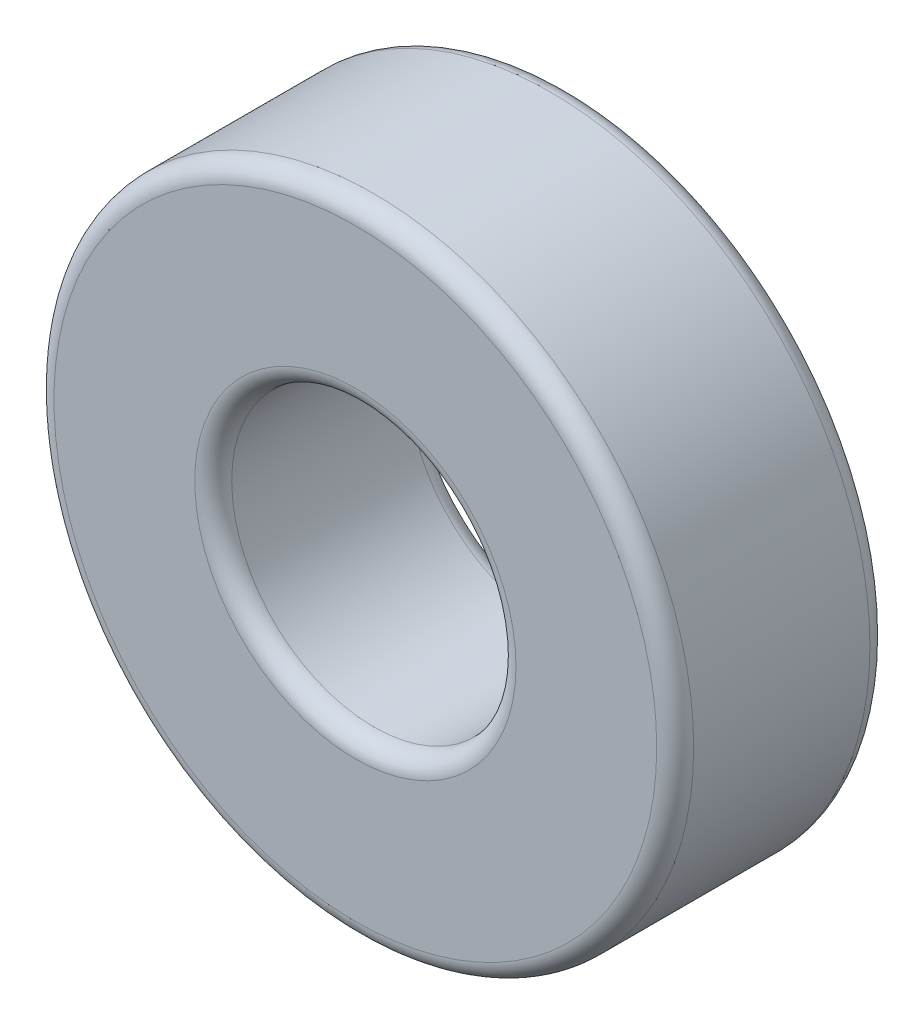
SolidWorks part; units mm, degrees
ref_plane "Front Plane" through (0, 0, 0) normal (0, 0, 1) x (1, 0, 0)
ref_plane "Top Plane" through (0, 0, 0) normal (0, 1, 0) x (1, 0, 0)
ref_plane "Right Plane" through (0, 0, 0) normal (1, 0, 0) x (0, 0, -1)
sketch "Sketch1" plane through (0, 0, 0) normal (0, 0, 1) x (1, 0, 0)
  circle A0 centre (0, 0) radius 14.2875
  circle A1 centre (0, 0) radius 6.35
  dimension "D1" = 12.7
  dimension "D2" = 28.575
extrude "Extrude1" add sketch "Sketch1" along normal mid plane 9.525
fillet "Fillet1" radius 0.8255 4 edges at (6.35, 0, -4.7625) (6.35, 0, 4.7625) (14.2875, 0, -4.7625) (14.2875, 0, 4.7625)
